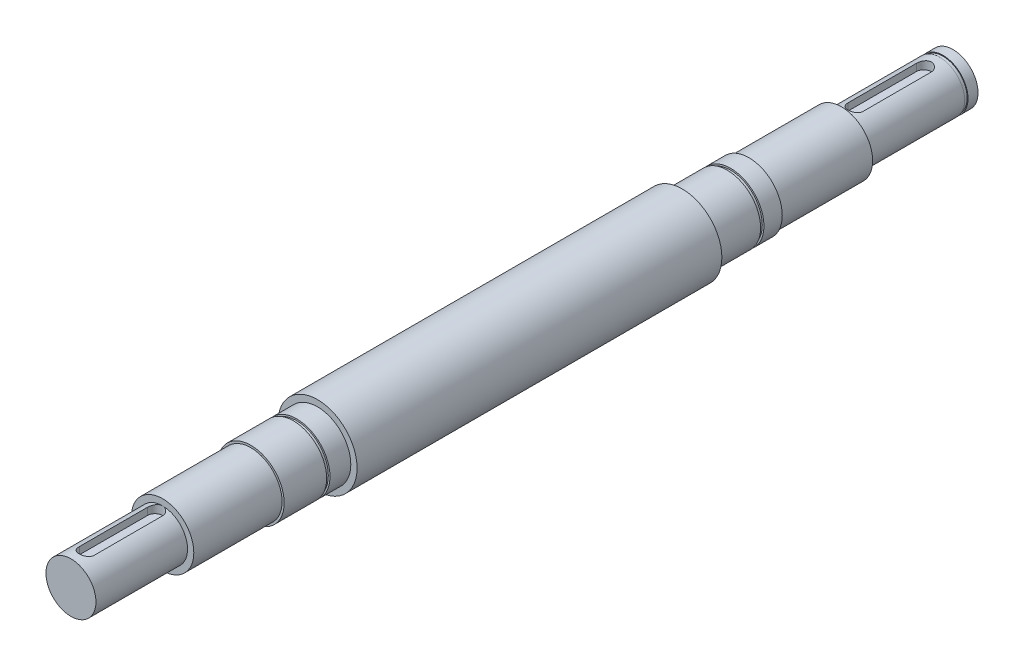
SolidWorks part; units mm, degrees
ref_plane "Front Plane" through (0, 0, 0) normal (0, 0, 1) x (1, 0, 0)
ref_plane "Top Plane" through (0, 0, 0) normal (0, 1, 0) x (1, 0, 0)
ref_plane "Right Plane" through (0, 0, 0) normal (1, 0, 0) x (0, 0, -1)
sketch "Sketch1" plane through (0, 0, 0) normal (1, 0, 0) x (0, 0, -1)
  line L0 (529.5, 0) -> (529.5, 30)
  line L1 (529.5, 30) -> (395.5, 30)
  line L2 (395.5, 30) -> (395.5, 37.5)
  line L3 (395.5, 37.5) -> (284.5, 37.5)
  line L4 (284.5, 37.5) -> (284.5, 40)
  line L5 (284.5, 40) -> (204.5, 40)
  line L6 (204.5, 40) -> (204.5, 47.5)
  line L7 (204.5, 47.5) -> (-233.5, 47.5)
  line L8 (-233.5, 47.5) -> (-233.5, 40)
  line L9 (-233.5, 40) -> (-313.5, 40)
  line L10 (-313.5, 40) -> (-313.5, 37.5)
  line L11 (-313.5, 37.5) -> (-419.5, 37.5)
  line L12 (-419.5, 37.5) -> (-419.5, 30)
  line L13 (-419.5, 30) -> (-529.5, 30)
  line L14 (-529.5, 30) -> (-529.5, 0)
  line L15 (-529.5, 0) -> (529.5, 0)
  dimension "D1" = 1059
  dimension "D2" = 134
  dimension "D3" = 111
  dimension "D4" = 80
  dimension "D5" = 110
  dimension "D6" = 106
  dimension "D7" = 80
  dimension "D8" = 30
  dimension "D9" = 37.5
  dimension "D10" = 40
  dimension "D11" = 30
  dimension "D12" = 37.5
  dimension "D13" = 40
  dimension "D14" = 47.5
revolve "Revolve1" add sketch "Sketch1" angle 360 about L15
sketch "Sketch2" plane through (0, 0, 0) normal (1, 0, 0) x (0, 0, -1)
  line L0 (529.5, 30) -> (395.5, 30) construction
  line L1 (513.5, 30) -> (517.5, 30)
  line L2 (513.5, 30) -> (513.5, 29)
  line L3 (513.5, 29) -> (517.5, 29)
  line L4 (517.5, 30) -> (517.5, 29)
  line L5 (0, 0) -> (529.5, 0) construction
  line L6 (529.5, -30) -> (529.5, 30) construction
  dimension "D1" = 4
  dimension "D2" = 12
  dimension "D3" = 1
revolve "Cut-Revolve1" cut sketch "Sketch2" angle 360 about L5
sketch "Sketch3" plane through (0, 0, 0) normal (1, 0, 0) x (0, 0, -1)
  line L0 (284.5, 40) -> (204.5, 40) construction
  line L1 (258.5, 40) -> (262.5, 40)
  line L2 (258.5, 40) -> (258.5, 38)
  line L3 (258.5, 38) -> (262.5, 38)
  line L4 (262.5, 40) -> (262.5, 38)
  line L5 (284.5, -40) -> (284.5, 40) construction
  line L6 (0, 0) -> (529.5, 0) construction
  line L7 (529.5, -30) -> (529.5, 30) construction
  line L9 (204.5, 40) -> (208.5, 40)
  line L10 (204.5, 40) -> (204.5, 38)
  line L11 (204.5, 38) -> (208.5, 38)
  line L12 (208.5, 40) -> (208.5, 38)
  dimension "D1" = 22
  dimension "D2" = 4
  dimension "D3" = 2
  dimension "D4" = 4
  dimension "D5" = 2
revolve "Cut-Revolve2" cut sketch "Sketch3" angle 360 about L6
mirror "Mirror1" about plane through (0, 0, 0) normal (0, 0, 1) of "Cut-Revolve2"
ref_plane "Plane2" through (0, 30, 0) normal (0, 1, 0) x (1, 0, 0)
sketch "Sketch9" plane through (0, 30, 0) normal (0, 1, 0) x (1, 0, 0)
  line L0 (0, -428.5) -> (0, -510.5) construction
  line L1 (9, -428.5) -> (9, -510.5)
  line L2 (-9, -428.5) -> (-9, -510.5)
  line L3 (-30, -419.5) -> (30, -419.5) construction
  arc A0 (9, -428.5) -> (-9, -428.5) centre (0, -428.5) ccw
  arc A1 (-9, -510.5) -> (9, -510.5) centre (0, -510.5) ccw
  point P3 (0, -469.5)
  point P8 (0, -433.3187)
  dimension "D1" = 82
  dimension "D2" = 18
extrude "Cut-Extrude1" cut sketch "Sketch9" against normal blind 10
ref_plane "Plane3" through (0, 30, 0) normal (0, 1, 0) x (1, 0, 0)
sketch "Sketch10" plane through (0, 30, 0) normal (0, 1, 0) x (1, 0, 0)
  line L0 (0, 412.5) -> (0, 494.5) construction
  line L1 (-9, 412.5) -> (-9, 494.5)
  line L2 (9, 412.5) -> (9, 494.5)
  line L3 (37.5, 395.5) -> (-37.5, 395.5) construction
  arc A0 (-9, 412.5) -> (9, 412.5) centre (0, 412.5) ccw
  arc A1 (9, 494.5) -> (-9, 494.5) centre (0, 494.5) ccw
  point P3 (0, 453.5)
  dimension "D1" = 82
  dimension "D2" = 18
  dimension "D3" = 17
extrude "Cut-Extrude2" cut sketch "Sketch10" against normal blind 10
